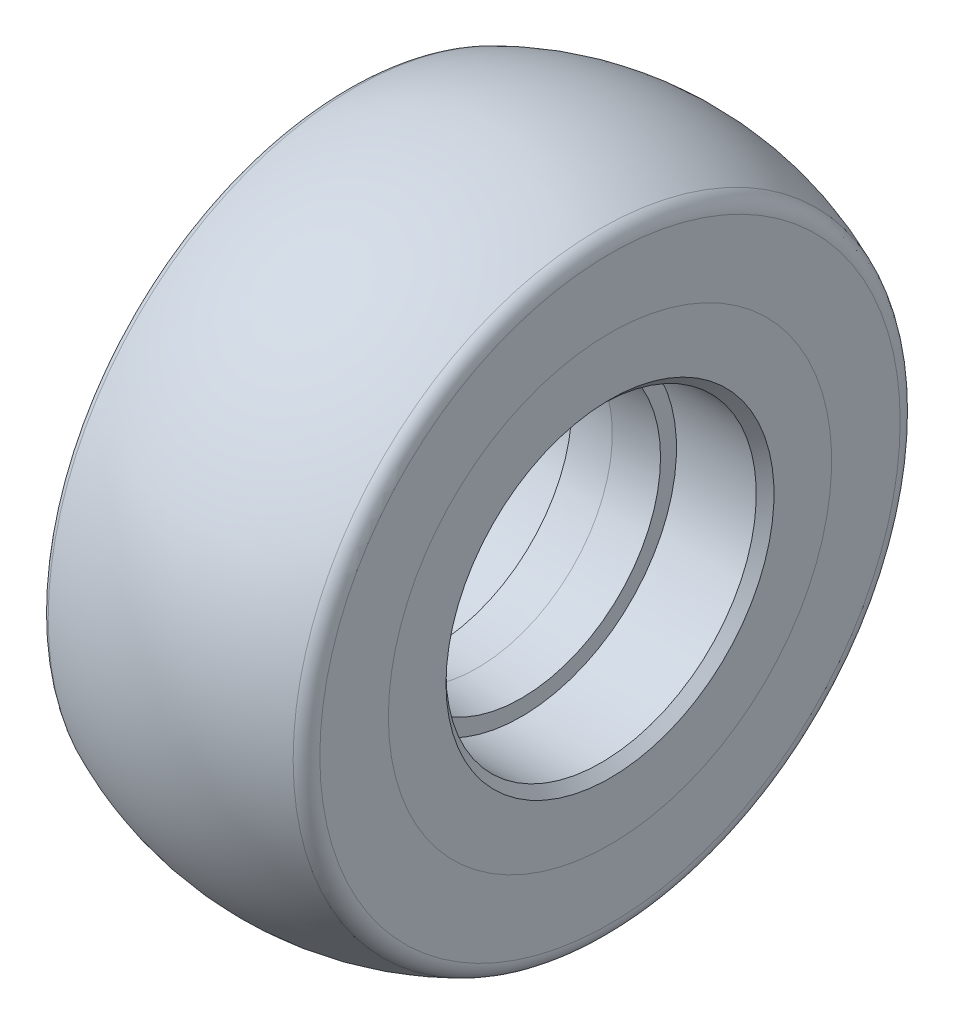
SolidWorks part; units mm, degrees
ref_plane "前视基准面" through (0, 0, 0) normal (0, 0, 1) x (1, 0, 0)
ref_plane "上视基准面" through (0, 0, 0) normal (0, 1, 0) x (1, 0, 0)
ref_plane "右视基准面" through (0, 0, 0) normal (1, 0, 0) x (0, 0, -1)
sketch "草图1" plane through (0, 0, 0) normal (0, 1, 0) x (1, 0, 0)
  line L0 (15, 18.5) -> (15, 25)
  line L1 (14, 17.5) -> (15, 18.5)
  line L2 (5, 17.5) -> (14, 17.5)
  line L3 (5, 15.7) -> (5, 17.5)
  line L4 (5, 15.7) -> (0, 15.2626)
  line L5 (0, 15.2626) -> (-5, 15.7)
  line L6 (-5, 17.5) -> (-5, 15.7)
  line L7 (-14, 17.5) -> (-5, 17.5)
  line L8 (-15, 18.5) -> (-14, 17.5)
  line L9 (-15, 25) -> (-15, 18.5)
  line L10 (-15, 25) -> (-10.5493, 25.4451)
  line L11 (-9.5062, 25.7469) -> (-7.5348, 26.7326)
  line L12 (-6.4072, 27.0417) -> (0, 27.5)
  line L13 (0, 27.5) -> (6.4072, 27.0417)
  line L14 (7.5348, 26.7326) -> (9.5062, 25.7469)
  line L15 (10.5493, 25.4451) -> (15, 25)
  line L16 (-18.9391, 0) -> (18.9391, 0) construction
  arc A0 (-10.5493, 25.4451) -> (-9.5062, 25.7469) centre (-10.8478, 28.4302) ccw
  arc A1 (-6.4072, 27.0417) -> (-7.5348, 26.7326) centre (-6.1932, 24.0493) ccw
  arc A2 (7.5348, 26.7326) -> (6.4072, 27.0417) centre (6.1932, 24.0493) ccw
  arc A3 (9.5062, 25.7469) -> (10.5493, 25.4451) centre (10.8478, 28.4302) ccw
revolve "旋转1" add sketch "草图1" angle 360 about L16
sketch "草图2" plane through (0, 0, 0) normal (0, 1, 0) x (1, 0, 0)
  line L0 (-15, 25) -> (-10.5493, 25.4451)
  line L1 (-9.5062, 25.7469) -> (-7.5348, 26.7326)
  line L2 (-6.4072, 27.0417) -> (0, 27.5)
  line L3 (0, 27.5) -> (6.4072, 27.0417)
  line L4 (7.5348, 26.7326) -> (9.5062, 25.7469)
  line L5 (10.5493, 25.4451) -> (15, 25)
  line L6 (15, 25) -> (15, 32.7309)
  line L7 (-15, 32.7309) -> (-15, 25)
  line L8 (-18.9391, 0) -> (18.9391, 0) construction
  arc A0 (-10.5493, 25.4451) -> (-9.5062, 25.7469) centre (-10.8478, 28.4302) ccw
  arc A1 (-6.4072, 27.0417) -> (-7.5348, 26.7326) centre (-6.1932, 24.0493) ccw
  arc A2 (7.5348, 26.7326) -> (6.4072, 27.0417) centre (6.1932, 24.0493) ccw
  arc A3 (9.5062, 25.7469) -> (10.5493, 25.4451) centre (10.8478, 28.4302) ccw
  arc A4 (15, 32.7309) -> (13.815, 34.5573) centre (13, 32.7309) ccw
  arc A5 (-13.815, 34.5573) -> (-15, 32.7309) centre (-13, 32.7309) ccw
  arc A6 (13.815, 34.5573) -> (-13.815, 34.5573) centre (0, 3.6) ccw
revolve "旋转2" add sketch "草图2" angle 360 about L8
